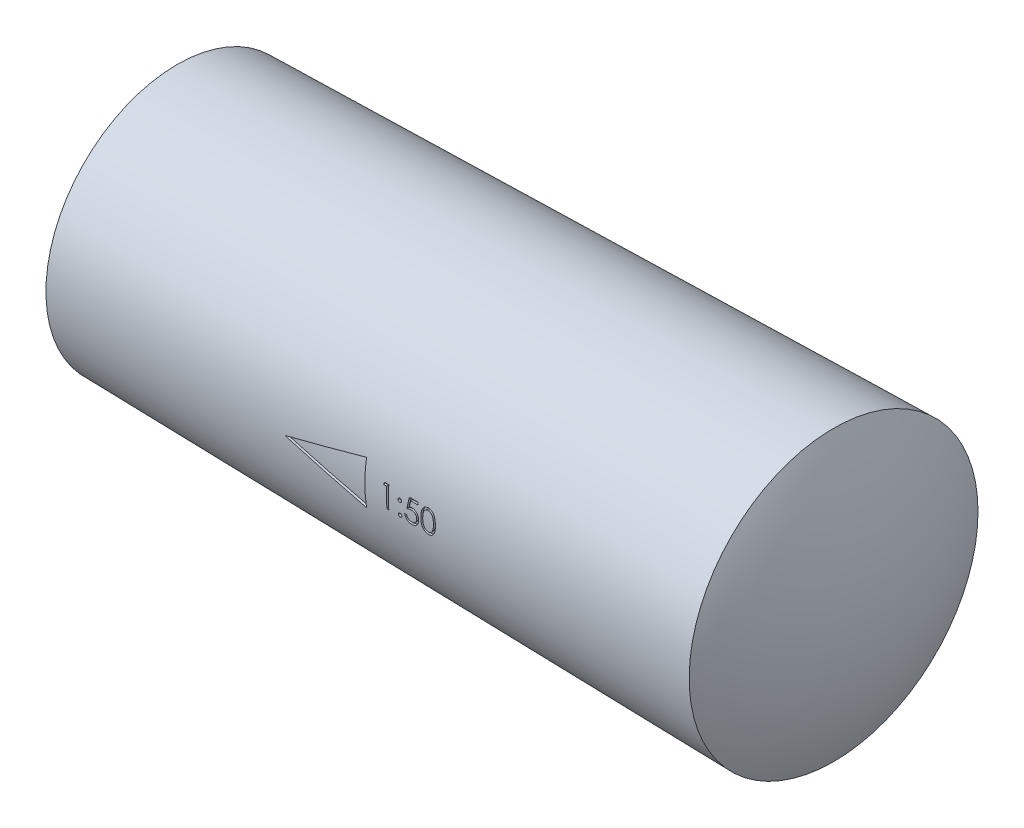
SolidWorks part; units mm, degrees
ref_plane "Front Plane" through (0, 0, 0) normal (0, 0, 1) x (1, 0, 0)
ref_plane "Top Plane" through (0, 0, 0) normal (0, 1, 0) x (1, 0, 0)
ref_plane "Right Plane" through (0, 0, 0) normal (1, 0, 0) x (0, 0, -1)
sketch "Sketch1" plane through (0, 0, 0) normal (1, 0, 0) x (0, 0, -1)
  circle A0 centre (0, 0) radius 6
  dimension "D1" = 12
extrude "Extrude1" add sketch "Sketch1" along normal mid plane 30
draft "Draft1" type of draft neutral plane draft angle 1.146 faces to draft 1 parameters "D1"=1.146
sketch "Sketch2" plane through (0, 0, 0) normal (0, 0, 1) x (1, 0, 0)
  line L0 (-15, 0) -> (-15, 6)
  line L1 (-15, 6) -> (-15, -6) construction
  line L2 (-15, 0) -> (-16.6, 0)
  line L3 (-16.6, 0) -> (-16.6, -6.3) construction
  line L4 (15, 0) -> (15, 6.6)
  line L5 (15, -6.6) -> (15, 6.6) construction
  line L6 (15, 0) -> (16.6, 0)
  line L7 (16.6, 0) -> (16.6, -6.3) construction
  line L8 (-15, -6) -> (15, -6.6) construction
  arc A0 (-16.6, 0) -> (-15, 6) centre (-4.55, 0) cw
  arc A1 (16.6, 0) -> (15, 6.6) centre (2.1874, 0) ccw
  point P14 (0, -6.3)
revolve "Revolve1" add sketch "Sketch2" angle 360 about L2
sketch "Sketch5" plane through (0, 0, 0) normal (0, 0, 1) x (1, 0, 0)
  line L0 (0, 6.3) -> (0, -6.3) construction
  line L1 (15, 6.6) -> (-15, 6) construction
  line L2 (-15, -6) -> (15, -6.6) construction
ref_plane "Plane2" through (0, 0, 0) normal (-0.02, 0, 0.9998) x (0.9998, 0, 0.02)
sketch "Sketch6" plane through (0, 0, 0) normal (-0.02, 0, 0.9998) x (0.9998, 0, 0.02)
  line L0 (0, 0) -> (0, 1)
  line L1 (0, 6.3) -> (0, -6.3) construction
  line L2 (0, 1) -> (-3.7321, 0)
  line L3 (-3.7321, 0) -> (0, -1)
  line L4 (0, -1) -> (0, 0)
  line L5 (0, -0.5) -> (4, -0.5) construction
  text T0 "1:50" font "Century Gothic" height 1
  dimension "D1" = 2
  dimension "D2" = 30
  dimension "D3" = 4
wrap "Wrap2" sketch "Sketch6" wrap type deboss source sketch "Sketch6" thickness 0.1 parameters "D1"=0.1
equation "\"D2@Sketch2\" = \"D1@Sketch2\""
